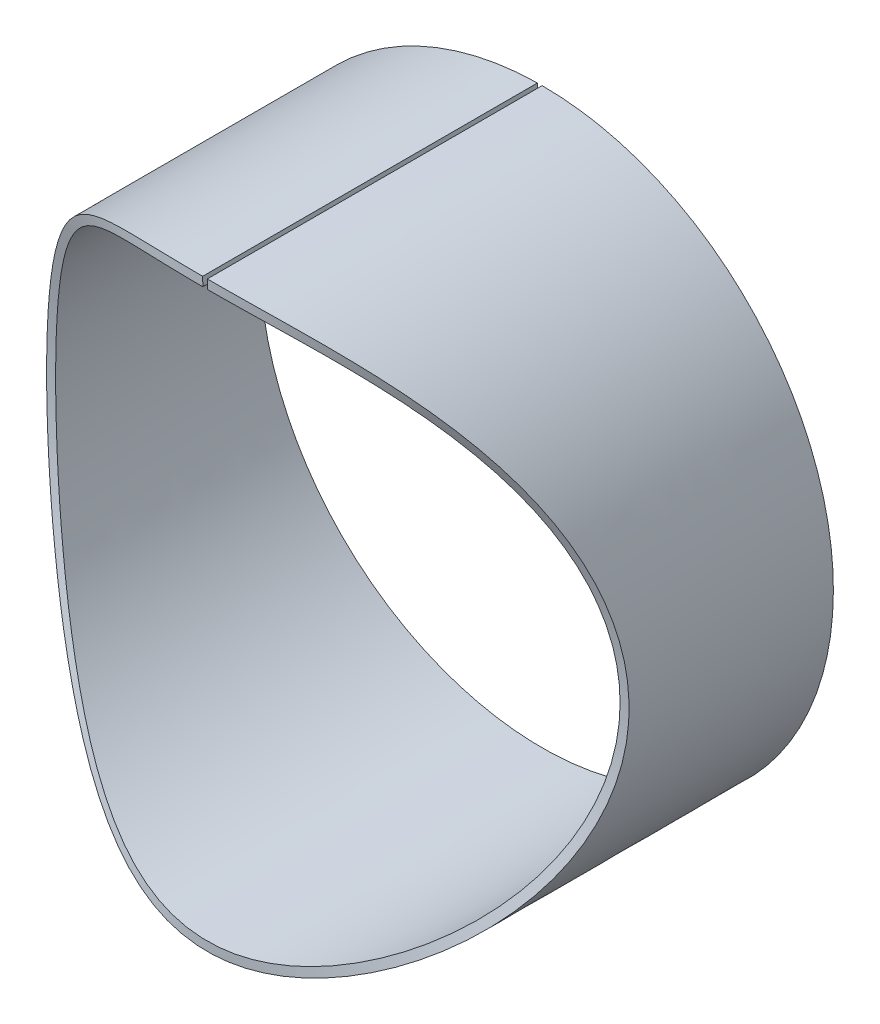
SolidWorks part; units mm, degrees
ref_plane "Ebene vorne" through (0, 0, 0) normal (0, 0, 1) x (1, 0, 0)
ref_plane "Ebene oben" through (0, 0, 0) normal (0, 1, 0) x (1, 0, 0)
ref_plane "Ebene rechts" through (0, 0, 0) normal (1, 0, 0) x (0, 0, -1)
sketch "Skizze1" plane through (0, 0, 0) normal (0, 0, 1) x (1, 0, 0)
  circle A0 centre (0, -80) radius 62.5 construction
  circle A1 centre (0, -80) radius 62.5
extrude "Linear-Austragen-Dünn1" add sketch "Skizze1" along normal up to surface (45.2345 mm away) thin
sketch "Skizze7" plane through (0, 0, 0) normal (1, 0, 0) x (0, 0, -1)
  line L1 (0, -28.6072) -> (-77.2202, -28.6072)
  line L2 (0, -28.6072) -> (0, -8.0085)
  line L3 (0, -8.0085) -> (-77.2202, -8.0085)
  line L4 (-77.2202, -28.6072) -> (-77.2202, -8.0085)
extrude "Linear austragen1" cut sketch "Skizze7" against normal blind 1
sketch "Skizze4" plane through (0, 0, 0) normal (0, 0, -1) x (-1, 0, 0)
  arc A2 (0, -17.5) -> (1, -17.508) centre (0, -80) ccw construction
  arc A3 (0, -17.5) -> (1, -17.508) centre (0, -80) ccw
sketch3d "3D-Skizze2"
  spline S2 degree 3 number of poles 170 (0, -17.5, 74.152) -> (-1, -17.508, 74.1426) construction
  spline S3 degree 3 number of poles 170 (0, -17.5, 74.152) -> (-1, -17.508, 74.1426)
delete or keep bodies "Körper-Löschen1" type delete bodies bodies 104
sheet metal parameters "Blech2" thickness 2 parameters "D1"=5, "Dicke"=2
lofted bend "Ausgeformte Biegungen1" parameters "D1"=0, "D12"=2
other "Freiform-Biegung1" parameters "D1"=1000, "D4"=57.296, "D5"=1
flat pattern "Abwicklung2"
sketch "Biegung-Linien2" plane through (0.2798, -17.4875, 0) normal (0.016, -0.9999, 0) x (0.9999, 0.016, 0)
  line L0 (-1.28, 0) -> (-1.28, 74.1426) construction
  line L1 (-399.6387, 0.0026) -> (-399.6402, 74.1546) construction
other "Abwickeln-<Freiform-Biegung1>1"
